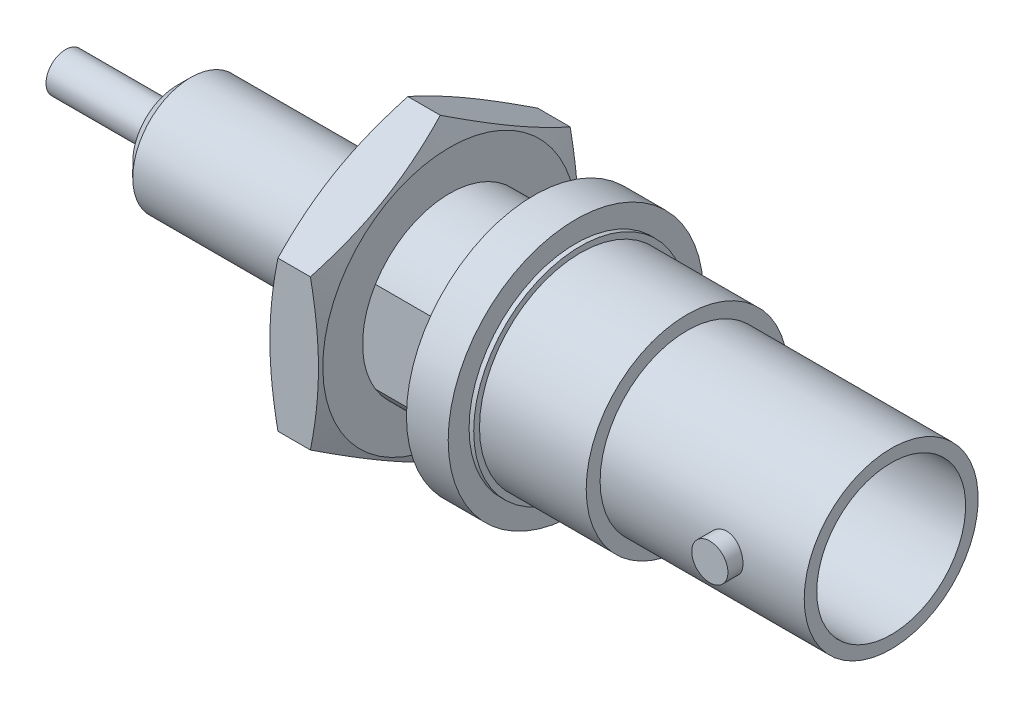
SolidWorks part; units mm, degrees
ref_plane "Front" through (0, 0, 0) normal (0, 0, 1) x (1, 0, 0)
ref_plane "Top" through (0, 0, 0) normal (0, 1, 0) x (1, 0, 0)
ref_plane "Right" through (0, 0, 0) normal (1, 0, 0) x (0, 0, -1)
sketch "Sketch7" plane through (0, 0, 0) normal (0, 0, 1) x (1, 0, 0)
  line L0 (-25.654, 0) -> (2.286, 0)
  line L1 (-8.5852, 3.175) -> (-8.5852, 4.7625)
  line L2 (-8.5852, 4.7625) -> (0, 4.7625)
  line L3 (0, 4.7625) -> (0, 6.985)
  line L4 (0, 6.985) -> (2.286, 6.985)
  line L5 (2.286, 6.985) -> (2.286, 5.842)
  line L6 (2.286, 5.842) -> (2.54, 5.842)
  line L7 (2.54, 5.842) -> (2.54, 5.5245)
  line L8 (2.54, 5.5245) -> (8.382, 5.5245)
  line L9 (8.382, 5.5245) -> (8.382, 4.7625)
  line L10 (8.382, 4.7625) -> (19.558, 4.7625)
  line L11 (19.558, 4.7625) -> (19.558, 4.0767)
  line L12 (19.558, 4.0767) -> (2.286, 4.0767)
  line L13 (-25.654, 1.0668) -> (-25.654, 0)
  line L14 (0, 0) -> (22.1501, 0) construction
  line L15 (0, 0) -> (0, 4.0767) construction
  line L16 (2.286, 4.0767) -> (2.286, 0)
  line L17 (-8.5852, 3.175) -> (-19.558, 3.175)
  line L18 (-19.558, 3.175) -> (-19.558, 1.0668)
  line L19 (-19.558, 1.0668) -> (-25.654, 1.0668)
  dimension "D1" = 13.97
  dimension "D2" = 11.684
  dimension "D3" = 11.049
  dimension "D4" = 9.525
  dimension "D5" = 45.212
  dimension "D6" = 11.176
  dimension "D7" = 17.018
  dimension "D8" = 17.272
  dimension "D9" = 2.286
  dimension "D10" = 28.1432
  dimension "D11" = 9.525
  dimension "D12" = 6.35
  dimension "D13" = 8.1534
  dimension "D14" = 39.116
  dimension "D15" = 2.1336
revolve "Revolve1" add sketch "Sketch7" angle 360 about L14
sketch "Sketch8" plane through (0, 0, 0) normal (0, 0, 1) x (1, 0, 0)
  line L0 (19.558, -4.7625) -> (19.558, 4.7625) construction
  circle A0 centre (15.2146, 0) radius 0.9906
  dimension "D1" = 1.9812
  dimension "D2" = 5.334
extrude "Boss-Extrude1" add sketch "Sketch8" along normal mid plane 11.176
sketch "Sketch9" plane through (19.558, 0, 0) normal (1, 0, 0) x (0, 0, -1)
  circle A0 centre (0, 0) radius 4.0767 construction
  circle A1 centre (0, 0) radius 4.0767
extrude "Cut-Extrude3" cut sketch "Sketch9" against normal up to surface (17.272 mm away)
sketch "Sketch12" plane through (0, 0, 0) normal (-1, 0, 0) x (0, 0, 1)
  line L1 (4.064, 4.989) -> (6.943, 4.989)
  line L2 (4.064, 4.989) -> (4.064, -4.6816)
  line L3 (4.064, -4.6816) -> (6.943, -4.6816)
  line L4 (6.943, 4.989) -> (6.943, -4.6816)
  dimension "D1" = 4.064
extrude "Cut-Extrude4" cut sketch "Sketch12" along normal up to surface (8.5852 mm away)
ref_plane "PANEL THK" through (-4.6228, 0, 0) normal (-1, 0, 0) x (0, 0, 1)
sketch "Sketch10" plane through (-4.6228, 0, 0) normal (-1, 0, 0) x (0, 0, 1)
  line L1 (7.112, 4.1061) -> (0, 8.2122)
  line L2 (0, 8.2122) -> (-7.112, 4.1061)
  line L3 (-7.112, 4.1061) -> (-7.112, -4.1061)
  line L4 (-7.112, -4.1061) -> (0, -8.2122)
  line L5 (0, -8.2122) -> (7.112, -4.1061)
  line L6 (7.112, -4.1061) -> (7.112, 4.1061)
  circle A0 centre (0, 0) radius 7.112 construction
  circle A1 centre (0, 0) radius 4.7625
  arc A2 (4.064, 2.483) -> (4.064, -2.483) centre (0, 0) ccw construction
  dimension "D1" = 14.224
extrude "Boss-Extrude2" add sketch "Sketch10" along normal blind 2.794
sketch "Sketch11" plane through (0, 0, 0) normal (0, 0, 1) x (1, 0, 0)
  line L0 (-7.4168, 8.2122) -> (-6.9088, 8.2122)
  line L1 (-6.9088, 8.2122) -> (-7.4168, 6.9422)
  line L2 (-7.4168, 6.9422) -> (-7.4168, 8.2122)
  line L3 (-6.0198, 8.2122) -> (-6.0198, 11.6434) construction
  line L4 (-7.4168, 8.2122) -> (-4.6228, 8.2122) construction
  line L5 (-4.6228, 6.9422) -> (-4.6228, 8.2122)
  line L6 (-5.1308, 8.2122) -> (-4.6228, 6.9422)
  line L7 (-4.6228, 8.2122) -> (-5.1308, 8.2122)
  line L9 (-7.4168, 4.1061) -> (-7.4168, 8.2122) construction
  line L10 (0, 0) -> (-4.4718, 0) construction
  dimension "D1" = 0.508
  dimension "D2" = 1.27
revolve "Cut-Revolve1" cut sketch "Sketch11" angle 360 about L10
chamfer "Chamfer1" distance 0.762 angle 45 1 edges at (-19.558, 0, 3.175)
